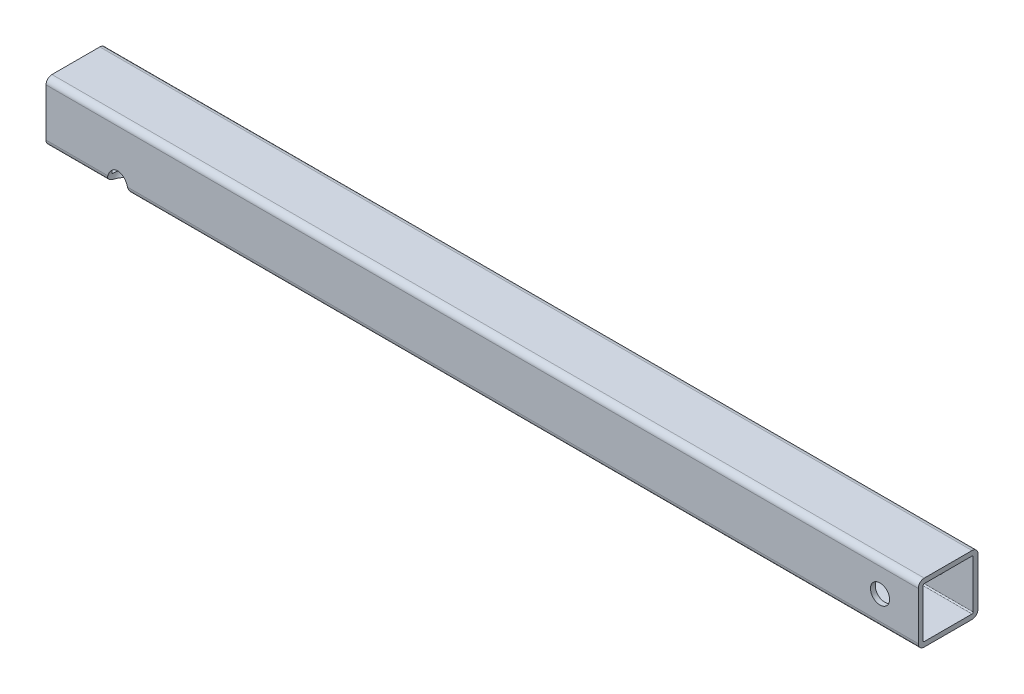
SolidWorks part; units mm, degrees
ref_plane "Plan de face" through (0, 0, 0) normal (0, 0, 1) x (1, 0, 0)
ref_plane "Plan de dessus" through (0, 0, 0) normal (0, 1, 0) x (1, 0, 0)
ref_plane "Plan de droite" through (0, 0, 0) normal (1, 0, 0) x (0, 0, -1)
sketch "Esquisse1" plane through (0, 0, 0) normal (1, 0, 0) x (0, 0, -1)
  line L0 (-10, 10.5) -> (10, 10.5)
  line L1 (-10, 12.5) -> (10, 12.5)
  line L2 (-12.5, 10) -> (-12.5, -10)
  line L3 (-10, -12.5) -> (10, -12.5)
  line L4 (12.5, 10) -> (12.5, -10)
  line L5 (-12.5, 12.5) -> (12.5, -12.5) construction
  line L6 (-12.5, -12.5) -> (12.5, 12.5) construction
  line L7 (10.5, 10) -> (10.5, -10)
  line L8 (-10, -10.5) -> (10, -10.5)
  line L9 (-10.5, 10) -> (-10.5, -10)
  arc A0 (-12.5, -10) -> (-10, -12.5) centre (-10, -10) ccw
  arc A1 (10, -12.5) -> (12.5, -10) centre (10, -10) ccw
  arc A2 (10, 12.5) -> (12.5, 10) centre (10, 10) cw
  arc A3 (-10, 12.5) -> (-12.5, 10) centre (-10, 10) ccw
  arc A4 (10, 10.5) -> (10.5, 10) centre (10, 10) cw
  arc A5 (10, -10.5) -> (10.5, -10) centre (10, -10) ccw
  arc A6 (-10.5, -10) -> (-10, -10.5) centre (-10, -10) ccw
  arc A7 (-10, 10.5) -> (-10.5, 10) centre (-10, 10) ccw
  point P0 (0, 0)
  dimension "D2" = 2.5
  dimension "D1" = 25
  dimension "D3" = 2
extrude "Boss.-Extru.1" add sketch "Esquisse1" along normal blind 365
sketch "Esquisse2" plane through (0, 0, 12.5) normal (0, 0, 1) x (1, 0, 0)
  line L1 (365, 10) -> (365, -10) construction
  circle A0 centre (349, 0) radius 4
  dimension "D1" = 8
  dimension "D2" = 16
extrude "Enlèv. mat.-Extru.1" cut sketch "Esquisse2" against normal through all
ref_plane "Plan1" through (0, -11.7678, 11.7678) normal (0, -0.7071, 0.7071) x (-1, 0, 0)
sketch "Esquisse3" plane through (0, -11.7678, 11.7678) normal (0, -0.7071, 0.7071) x (-1, 0, 0)
  line L0 (0, -15.9099) -> (0, -1.7678) construction
  circle A0 centre (-30, 0) radius 4.5
  dimension "D1" = 9
  dimension "D2" = 30
extrude "Enlèv. mat.-Extru.2" cut sketch "Esquisse3" against normal up to next
